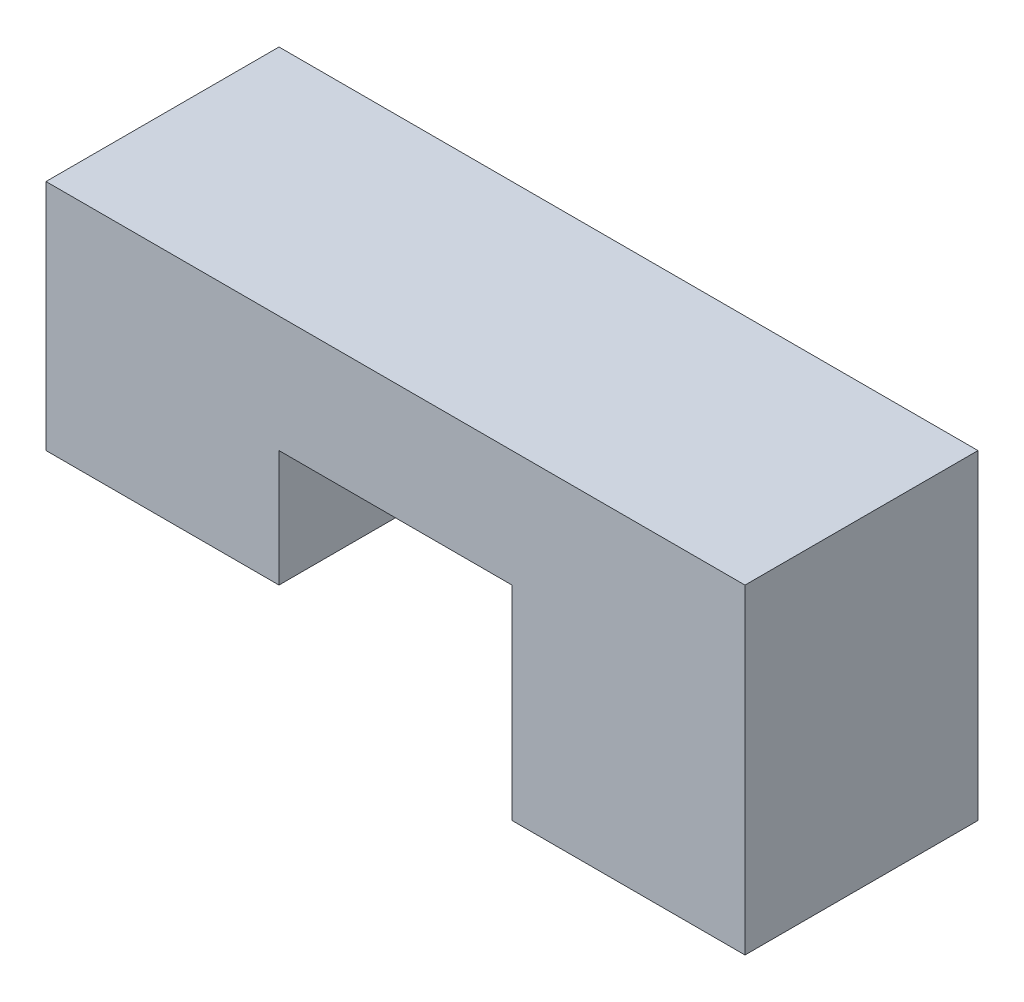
SolidWorks part; units mm, degrees
ref_plane "前视基准面" through (0, 0, 0) normal (0, 0, 1) x (1, 0, 0)
ref_plane "上视基准面" through (0, 0, 0) normal (0, 1, 0) x (1, 0, 0)
ref_plane "右视基准面" through (0, 0, 0) normal (1, 0, 0) x (0, 0, -1)
other "Configuration Table"
sketch "草图1" plane through (0, 0, 0) normal (0, 1, 0) x (1, 0, 0)
  line L1 (-60, -20) -> (60, -20)
  line L2 (-60, -20) -> (-60, 20)
  line L3 (-60, 20) -> (60, 20)
  line L4 (60, -20) -> (60, 20)
extrude "凸台-拉伸1" add sketch "草图1" against normal blind 20
sketch "草图2" plane through (0, 0, 0) normal (0, 1, 0) x (1, 0, 0)
  line L0 (60, 20) -> (-60, 20) construction
  line L1 (-60, -20) -> (-20, -20)
  line L2 (-60, -20) -> (-60, 20)
  line L3 (-60, 20) -> (-20, 20)
  line L4 (-20, -20) -> (-20, 20)
extrude "凸台-拉伸2" add sketch "草图2" against normal blind 40
sketch "草图3" plane through (0, 0, 0) normal (0, 1, 0) x (1, 0, 0)
  line L0 (-60, -20) -> (60, -20) construction
  line L1 (20, -20) -> (60, -20)
  line L2 (20, -20) -> (20, 20)
  line L3 (20, 20) -> (60, 20)
  line L4 (60, -20) -> (60, 20)
extrude "凸台-拉伸3" add sketch "草图3" against normal blind 55
sketch "草图4" plane through (0, 0, 0) normal (0, 0, 1) x (1, 0, 0)
  circle A0 centre (-40, 30) radius 8
  circle A1 centre (40, 40) radius 8
